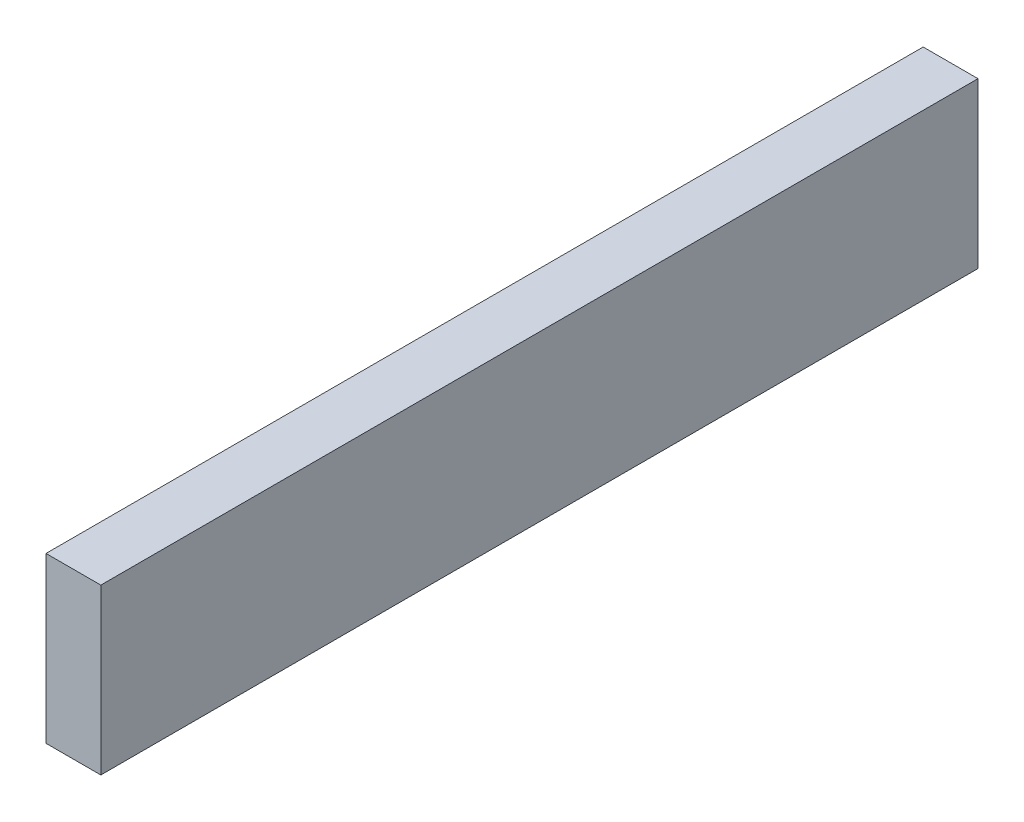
SolidWorks part; units mm, degrees
ref_plane "Front Plane" through (0, 0, 0) normal (0, 0, 1) x (1, 0, 0)
ref_plane "Top Plane" through (0, 0, 0) normal (0, 1, 0) x (1, 0, 0)
ref_plane "Right Plane" through (0, 0, 0) normal (1, 0, 0) x (0, 0, -1)
sketch "Sketch1" plane through (0, 0, 0) normal (0, 0, 1) x (1, 0, 0)
  line L1 (-12.7, -38.1) -> (12.7, -38.1)
  line L2 (-12.7, -38.1) -> (-12.7, 38.1)
  line L3 (-12.7, 38.1) -> (12.7, 38.1)
  line L4 (12.7, -38.1) -> (12.7, 38.1)
  line L5 (-12.7, -38.1) -> (12.7, 38.1) construction
  line L6 (-12.7, 38.1) -> (12.7, -38.1) construction
  point P0 (0, 0)
  dimension "D1" = 25.4
  dimension "D2" = 76.2
extrude "Boss-Extrude1" add sketch "Sketch1" against normal mid plane 406.4
hole_wizard "21/32 (0.65625) Diameter Hole1" positions "Sketch3" profile "Sketch2" hole size "21/32" standard "ANSI Inch"
sketch "Sketch3" plane through (0, 38.1, 0) normal (0, 1, 0) x (1, 0, 0)
  line L0 (0, 203.2) -> (0, -203.2) construction
  line L1 (12.7, 203.2) -> (-12.7, 203.2) construction
  line L2 (12.7, -203.2) -> (-12.7, -203.2) construction
  line L6 (5.4465, -44.45) -> (5.4465, -82.55) construction
  line L7 (-10.16, -44.45) -> (396.24, -44.45) construction
  line L8 (-10.16, -82.55) -> (396.24, -82.55) construction
  line L9 (5.4465, -63.5) -> (-23.2186, -63.5) construction
  line L10 (5.4465, -107.95) -> (5.4465, -146.05) construction
  line L11 (-10.16, -107.95) -> (396.24, -107.95) construction
  line L12 (-10.16, -146.05) -> (396.24, -146.05) construction
  line L13 (5.4465, -127) -> (-23.2186, -127) construction
  line L14 (0, 0) -> (-31.0042, 0) construction
  line L15 (5.4465, -171.45) -> (5.4465, -203.2) construction
  line L16 (-10.16, -171.45) -> (396.24, -171.45) construction
  line L17 (5.4465, -187.325) -> (-35.2509, -187.325) construction
  point P0 (0, 127)
  point P2 (0, 63.5)
  point P4 (0, 0)
  point P7 (0, -63.5)
  point P9 (0, -127)
  point P54 (0, -187.325)
  point P56 (0, 187.325)
sketch "Sketch2" plane through (0, 38.1, -149.9969) normal (1, 0, 0) x (0, 0, 1)
  line L0 (0, 0) -> (0, 76.2)
  line L1 (0, 76.2) -> (8.3344, 76.2)
  line L2 (8.3344, 76.2) -> (8.3344, 0)
  line L5 (8.3344, 0) -> (0, 0)
  line L11 (0, -6.35) -> (0, 107.95) construction
  dimension "Thru Hole Dia." = 16.6687
  dimension "Thru Hole Depth" = 76.2
